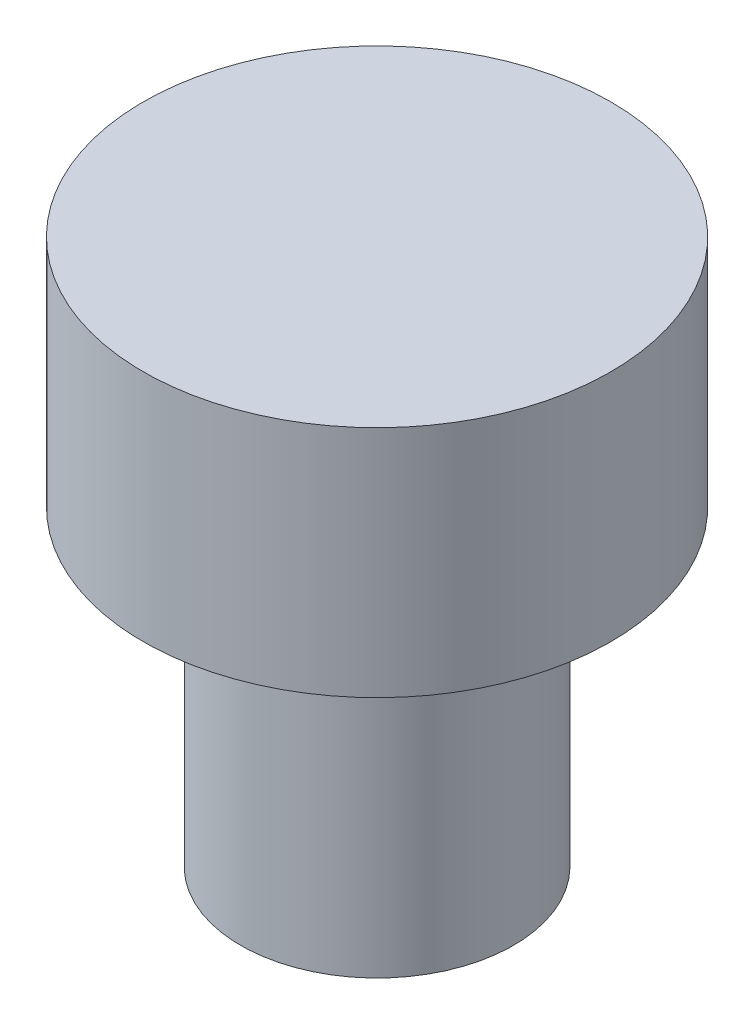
SolidWorks part; units mm, degrees
ref_plane "Front Plane" through (0, 0, 0) normal (0, 0, 1) x (1, 0, 0)
ref_plane "Top Plane" through (0, 0, 0) normal (0, 1, 0) x (1, 0, 0)
ref_plane "Right Plane" through (0, 0, 0) normal (1, 0, 0) x (0, 0, -1)
sketch "Sketch1" plane through (0, 0, 0) normal (0, 0, 1) x (1, 0, 0)
  line L0 (0, 0) -> (0, 11.1125) construction
  line L1 (0, 11.1125) -> (4.7625, 11.1125)
  line L2 (4.7625, 11.1125) -> (4.7625, 6.35)
  line L3 (4.7625, 6.35) -> (2.7781, 6.35)
  line L4 (2.7781, 6.35) -> (2.7781, 0)
  line L5 (2.7781, 0) -> (0, 0)
  line L6 (0, 0) -> (0, 11.1125)
  dimension "D1" = 9.525
  dimension "D2" = 5.5563
  dimension "D3" = 4.7625
  dimension "D4" = 6.35
revolve "Revolve1" add sketch "Sketch1" angle 360 about L0
